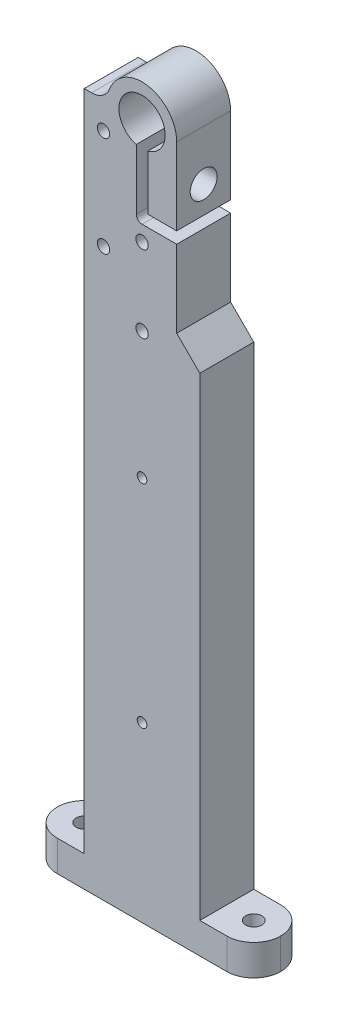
SolidWorks part; units mm, degrees
ref_plane "Спереди" through (0, 0, 0) normal (0, 0, 1) x (1, 0, 0)
ref_plane "Сверху" through (0, 0, 0) normal (0, 1, 0) x (1, 0, 0)
ref_plane "Справа" through (0, 0, 0) normal (1, 0, 0) x (0, 0, -1)
sketch "Эскиз1" plane through (0, 0, 0) normal (0, 0, 1) x (1, 0, 0)
  line L1 (0, 0) -> (30, 0)
  line L2 (0, 0) -> (0, 195)
  line L3 (0, 195) -> (30, 195)
  line L4 (30, 0) -> (30, 195)
  dimension "D1" = 195
  dimension "D2" = 30
extrude "Бобышка-Вытянуть1" add sketch "Эскиз1" along normal blind 14
sketch "Эскиз2" plane through (0, 0, 0) normal (0, -1, 0) x (1, 0, 0)
  line L0 (0, 14) -> (0, 0) construction
  line L1 (-14, 0) -> (44, 0)
  line L2 (-14, 0) -> (-14, 14)
  line L3 (-14, 14) -> (44, 14)
  line L4 (44, 0) -> (44, 14)
  line L5 (30, 14) -> (30, 0) construction
  dimension "D1" = 14
  dimension "D2" = 14
  dimension "D3" = 14
extrude "Бобышка-Вытянуть2" add sketch "Эскиз2" against normal blind 8
sketch "Эскиз3" plane through (0, 0, 0) normal (0, -1, 0) x (1, 0, 0)
  line L0 (-14, 0) -> (44, 0) construction
  line L1 (-14, 14) -> (-14, 0) construction
  line L2 (44, 0) -> (44, 14) construction
  circle A0 centre (-7, 7) radius 2.1
  circle A1 centre (37, 7) radius 2.1
  dimension "D3" = 4.2
  dimension "D4" = 4.2
  dimension "D1" = 7
  dimension "D2" = 7
  dimension "D5" = 7
  dimension "D6" = 7
extrude "Вырез-Вытянуть1" cut sketch "Эскиз3" against normal blind 8
sketch "Эскиз5" plane through (0, 0, 14) normal (0, 0, 1) x (1, 0, 0)
  line L0 (0, 195) -> (0, 8) construction
  line L1 (-14, 0) -> (44, 0) construction
  circle A0 centre (15, 180) radius 6
  dimension "D1" = 12
  dimension "D2" = 15
  dimension "D3" = 180
extrude "Вырез-Вытянуть2" cut sketch "Эскиз5" against normal through all
fillet "Скругление10" radius 7 4 edges at (44, 4, 0) (44, 4, 14) (-14, 4, 14) (-14, 4, 0)
fillet "Скругление11" radius 15 2 edges at (30, 195, 7) (0, 195, 7)
sketch "Эскиз6" plane through (0, 0, 14) normal (0, 0, 1) x (1, 0, 0)
  line L0 (6, 180) -> (-7.4853, 180)
  line L2 (24, 180) -> (24, 175)
  line L5 (-7.4853, 180) -> (-7.4853, 217.4877)
  line L6 (-7.4853, 217.4877) -> (38.1079, 217.4877)
  line L7 (38.1079, 217.4877) -> (38.1079, 175)
  line L8 (38.1079, 175) -> (24, 175)
  arc A0 (24, 180) -> (6, 180) centre (15, 180) ccw
  circle A1 centre (15, 180) radius 6 construction
  dimension "D1" = 18
  dimension "D3" = 5
extrude "Вырез-Вытянуть3" cut sketch "Эскиз6" against normal through all
sketch "Эскиз8" plane through (0, 0, 14) normal (0, 0, 1) x (1, 0, 0)
  line L1 (13.5, 178.2457) -> (16.5, 178.2457)
  line L2 (13.5, 178.2457) -> (13.5, 157)
  line L3 (13.5, 157) -> (16.5, 157)
  line L4 (16.5, 178.2457) -> (16.5, 157)
  circle A0 centre (15, 180) radius 6 construction
  dimension "D1" = 1.5
  dimension "D2" = 1.5
  dimension "D3" = 23
extrude "Вырез-Вытянуть4" cut sketch "Эскиз8" against normal through all
sketch "Эскиз9" plane through (0, 0, 14) normal (0, 0, 1) x (1, 0, 0)
  line L1 (13.5, 157) -> (37.6151, 157)
  line L2 (13.5, 157) -> (13.5, 160)
  line L3 (13.5, 160) -> (37.6151, 160)
  line L4 (37.6151, 157) -> (37.6151, 160)
  dimension "D1" = 3
extrude "Вырез-Вытянуть5" cut sketch "Эскиз9" against normal through all
sketch "Эскиз10" plane through (0, 0, 14) normal (0, 0, 1) x (1, 0, 0)
  line L1 (24, 175) -> (30, 175)
  line L2 (24, 175) -> (24, 160)
  line L3 (24, 160) -> (30, 160)
  line L4 (30, 175) -> (30, 160)
extrude "Вырез-Вытянуть6" cut sketch "Эскиз10" against normal through all
fillet "Скругление12" radius 1.5 1 edges at (13.5, 157, 7)
sketch "Эскиз12" plane through (0, 0, 14) normal (0, 0, 1) x (1, 0, 0)
  line L0 (15, 157) -> (30, 157) construction
  line L1 (24, 180) -> (38.6559, 180)
  line L2 (24, 180) -> (24, 137)
  line L3 (24, 137) -> (38.6559, 137)
  line L4 (38.6559, 180) -> (38.6559, 137)
  dimension "D1" = 20
extrude "Вырез-Вытянуть7" cut sketch "Эскиз12" against normal through all
chamfer "Фаска1" distance 6 angle 45 1 edges at (30, 137, 7)
fillet "Скругление13" radius 5 1 edges at (6, 180, 7)
sketch "Эскиз13" plane through (24, 0, 0) normal (1, 0, 0) x (0, 0, -1)
  line L0 (-14, 180) -> (-14, 160) construction
  line L1 (0, 160) -> (-14, 160) construction
  circle A0 centre (-7, 167) radius 3.5
  dimension "D2" = 7
  dimension "D1" = 7
  dimension "D3" = 7
extrude "Вырез-Вытянуть8" cut sketch "Эскиз13" against normal up to surface (7.5 mm away)
sketch "Эскиз14" plane through (13.5, 0, 0) normal (1, 0, 0) x (0, 0, -1)
  circle A0 centre (-7, 167) radius 2.5
  dimension "D1" = 5
extrude "Вырез-Вытянуть9" cut sketch "Эскиз14" against normal through all
sketch "Эскиз15" plane through (0, 0, 14) normal (0, 0, 1) x (1, 0, 0)
  line L0 (0, 180) -> (0, 8) construction
  circle A0 centre (5, 173) radius 1.6
  arc A1 (16.5, 174.1905) -> (13.5, 174.1905) centre (15, 180) ccw construction
  dimension "D3" = 3.2
  dimension "D1" = 5
  dimension "D2" = 7
extrude "Вырез-Вытянуть10" cut sketch "Эскиз15" against normal through all
pattern_linear "Линейный массив1" count 2 spacing 26 along (0, -1, 0) of "Вырез-Вытянуть10"
sketch "Эскиз17" plane through (0, 0, 14) normal (0, 0, 1) x (1, 0, 0)
  line L0 (-7, 0) -> (37, 0) construction
  line L1 (0, 180) -> (0, 8) construction
  circle A0 centre (15, 45) radius 1.25
  dimension "D3" = 2.5
  dimension "D1" = 45
  dimension "D2" = 15
extrude "Вырез-Вытянуть12" cut sketch "Эскиз17" against normal through all
pattern_linear "Линейный массив2" count 2 spacing 55 along (0, 1, 0) of "Вырез-Вытянуть12"
sketch "Эскиз18" plane through (0, 0, 14) normal (0, 0, 1) x (1, 0, 0)
  line L0 (24, 157) -> (24, 137) construction
  line L1 (15, 157) -> (24, 157) construction
  circle A0 centre (15, 133) radius 1.6
  circle A1 centre (15, 153) radius 1.6
  dimension "D1" = 3.2
  dimension "D2" = 3.2
  dimension "D5" = 4
  dimension "D3" = 9
  dimension "D4" = 9
  dimension "D6" = 20
extrude "Вырез-Вытянуть13" cut sketch "Эскиз18" against normal through all
